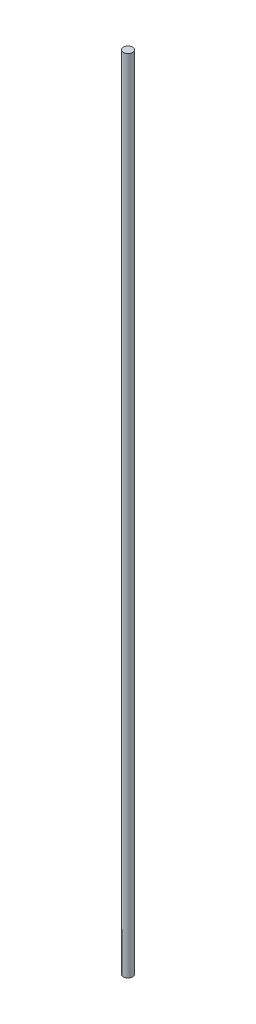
SolidWorks part; units mm, degrees
ref_plane "Front Plane" through (0, 0, 0) normal (0, 0, 1) x (1, 0, 0)
ref_plane "Top Plane" through (0, 0, 0) normal (0, 1, 0) x (1, 0, 0)
ref_plane "Right Plane" through (0, 0, 0) normal (1, 0, 0) x (0, 0, -1)
sketch "Sketch1" plane through (0, 0, 0) normal (0, 1, 0) x (1, 0, 0)
  circle A0 centre (0, 0) radius 0.875
  point P2 (0, 0)
  dimension "D1" = 1.75
extrude "Boss-Extrude1" add sketch "Sketch1" along normal blind 152.4
